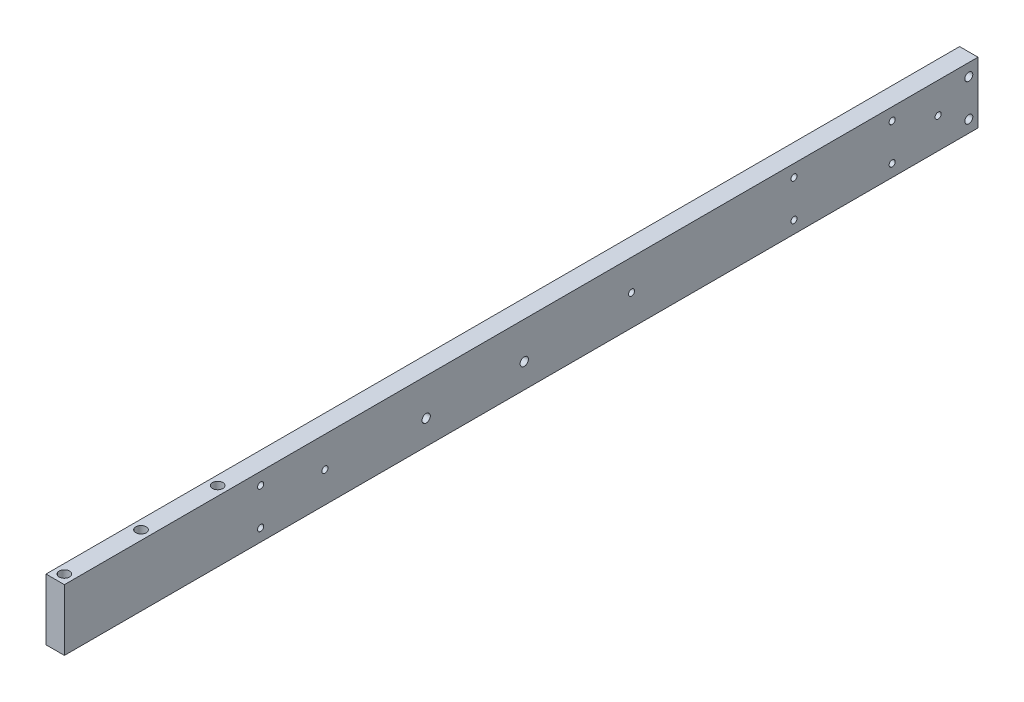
SolidWorks part; units mm, degrees
other "<TZ030512>-<Trou taraudé M81>"
ref_plane "Plan de face" through (0, 0, 0) normal (0, 0, 1) x (1, 0, 0)
ref_plane "Plan de dessus" through (0, 0, 0) normal (0, 1, 0) x (1, 0, 0)
ref_plane "Plan de droite" through (0, 0, 0) normal (1, 0, 0) x (0, 0, -1)
mirrored part "TZ030512_Rendre symétrique"
